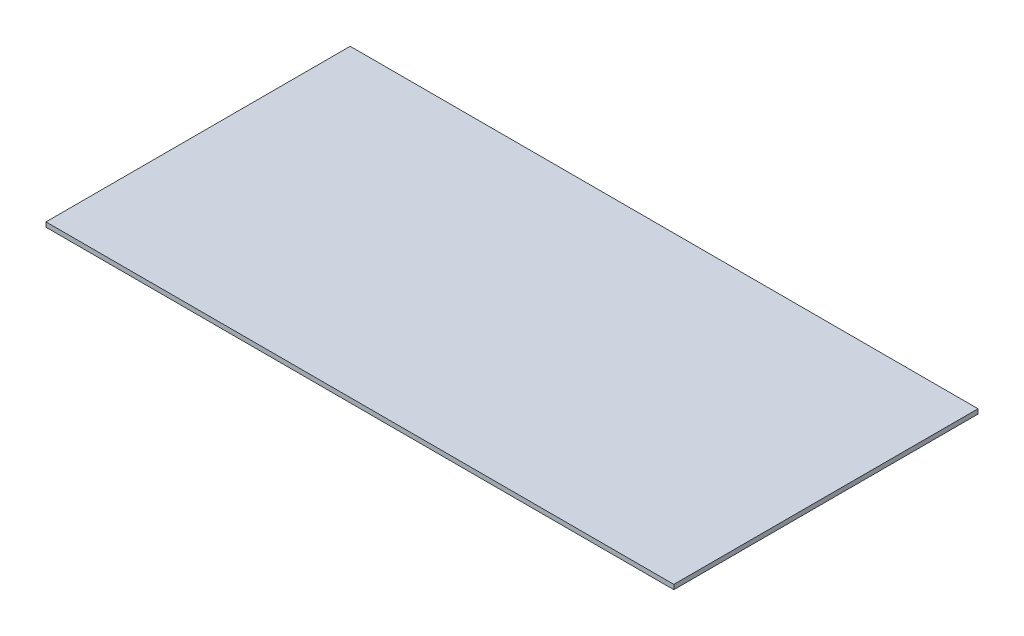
SolidWorks part; units mm, degrees
ref_plane "Plan de face" through (0, 0, 0) normal (0, 0, 1) x (1, 0, 0)
ref_plane "Plan de dessus" through (0, 0, 0) normal (0, 1, 0) x (1, 0, 0)
ref_plane "Plan de droite" through (0, 0, 0) normal (1, 0, 0) x (0, 0, -1)
sketch "Esquisse1" plane through (0, 0, 0) normal (0, 1, 0) x (1, 0, 0)
  line L1 (0, 0) -> (404.56, 0)
  line L2 (0, 0) -> (0, 196)
  line L3 (0, 196) -> (404.56, 196)
  line L4 (404.56, 0) -> (404.56, 196)
extrude "Boss.-Extru.1" add sketch "Esquisse1" along normal blind 3
